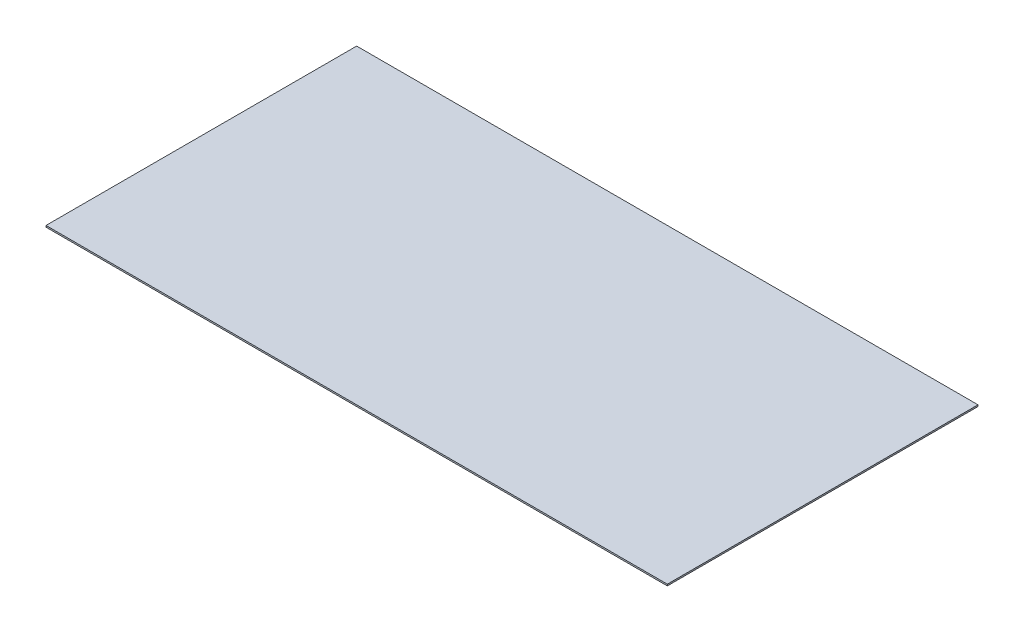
SolidWorks part; units mm, degrees
ref_plane "Alzado" through (0, 0, 0) normal (0, 0, 1) x (1, 0, 0)
ref_plane "Planta" through (0, 0, 0) normal (0, 1, 0) x (1, 0, 0)
ref_plane "Vista lateral" through (0, 0, 0) normal (1, 0, 0) x (0, 0, -1)
sketch "Croquis1" plane through (0, 0, 0) normal (0, 1, 0) x (1, 0, 0)
  line L1 (-1609.954, -1032.8405) -> (4390.046, -1032.8405)
  line L2 (-1609.954, -1032.8405) -> (-1609.954, 1967.1595)
  line L3 (-1609.954, 1967.1595) -> (4390.046, 1967.1595)
  line L4 (4390.046, -1032.8405) -> (4390.046, 1967.1595)
  dimension "D1" = 3000
  dimension "D2" = 6000
extrude "Saliente-Extruir1" add sketch "Croquis1" along normal blind 15
